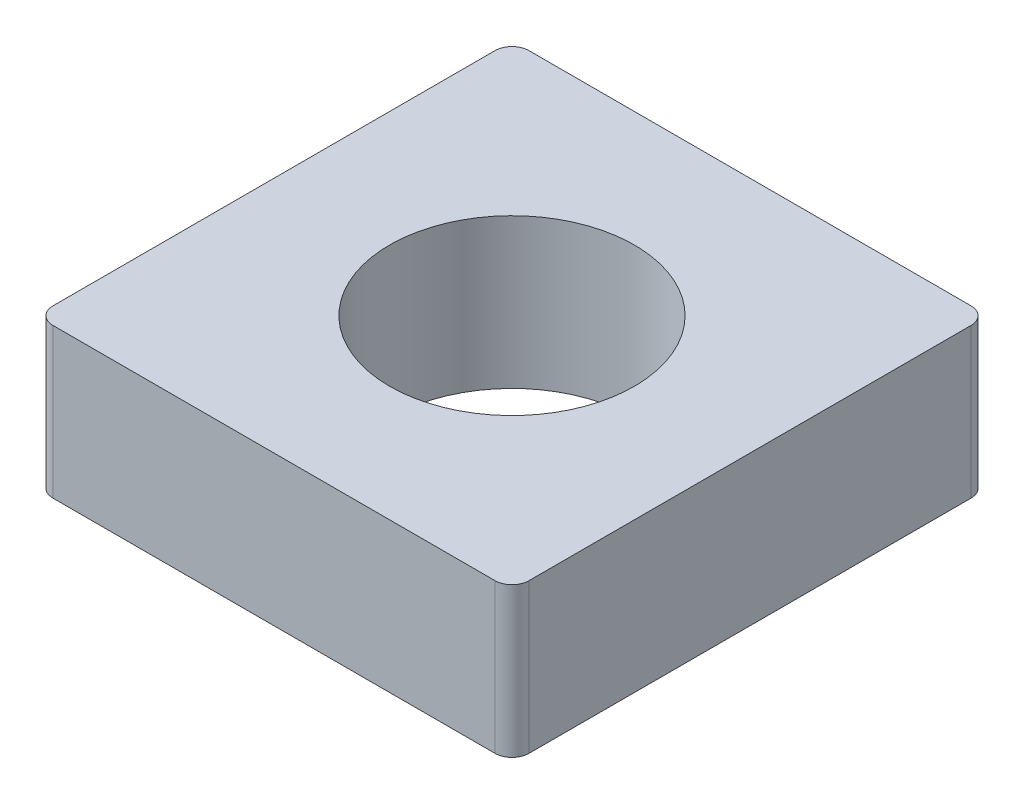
SolidWorks part; units mm, degrees
ref_plane "Front" through (0, 0, 0) normal (0, 0, 1) x (1, 0, 0)
ref_plane "Top" through (0, 0, 0) normal (0, 1, 0) x (1, 0, 0)
ref_plane "Right" through (0, 0, 0) normal (1, 0, 0) x (0, 0, -1)
sketch "Sketch1" plane through (0, 0, 0) normal (0, 1, 0) x (1, 0, 0)
  line L1 (3.5, -3.5) -> (-3.5, -3.5)
  line L2 (3.5, -3.5) -> (3.5, 3.5)
  line L3 (3.5, 3.5) -> (-3.5, 3.5)
  line L4 (-3.5, -3.5) -> (-3.5, 3.5)
  line L5 (3.5, -3.5) -> (-3.5, 3.5) construction
  line L6 (3.5, 3.5) -> (-3.5, -3.5) construction
  circle A0 centre (0, 0) radius 1.8
  point P0 (0, 0)
  dimension "D1" = 3.6
  dimension "D2" = 7
extrude "Boss-Extrude1" add sketch "Sketch1" along normal blind 2.2
fillet "Fillet1" radius 0.25 4 edges at (-3.5, 1.1, -3.5) (3.5, 1.1, -3.5) (-3.5, 1.1, 3.5) (3.5, 1.1, 3.5)
